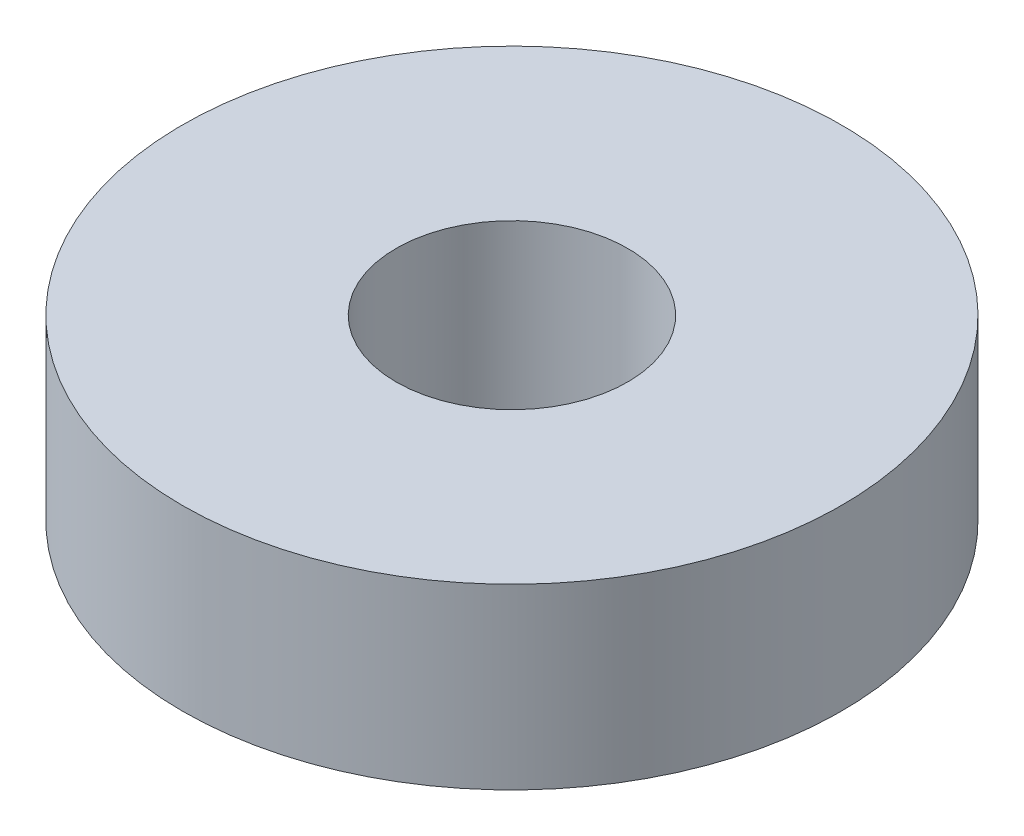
SolidWorks part; units mm, degrees
ref_plane "Front Plane" through (0, 0, 0) normal (0, 0, 1) x (1, 0, 0)
ref_plane "Top Plane" through (0, 0, 0) normal (0, 1, 0) x (1, 0, 0)
ref_plane "Right Plane" through (0, 0, 0) normal (1, 0, 0) x (0, 0, -1)
sketch "Sketch1" plane through (0, 0, 0) normal (0, 1, 0) x (1, 0, 0)
  circle A0 centre (0, 0) radius 3.302
  circle A1 centre (0, 0) radius 9.398
  dimension "D1" = 6.604
  dimension "D2" = 18.796
extrude "Boss-Extrude1" add sketch "Sketch1" along normal blind 5.08
